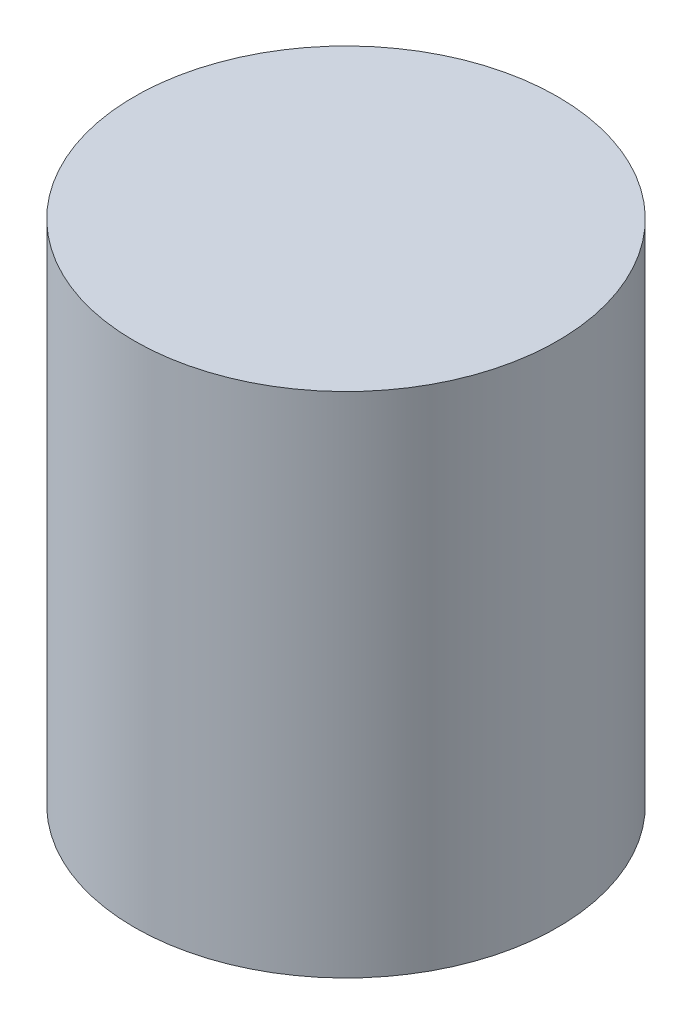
SolidWorks part; units mm, degrees
ref_plane "前视基准面" through (0, 0, 0) normal (0, 0, 1) x (1, 0, 0)
ref_plane "上视基准面" through (0, 0, 0) normal (0, 1, 0) x (1, 0, 0)
ref_plane "右视基准面" through (0, 0, 0) normal (1, 0, 0) x (0, 0, -1)
other "Configuration Table"
sketch "草图1" plane through (0, 0, 0) normal (0, 1, 0) x (1, 0, 0)
  circle A0 centre (0, 0) radius 50
extrude "凸台-拉伸1" add sketch "草图1" along normal blind 120
